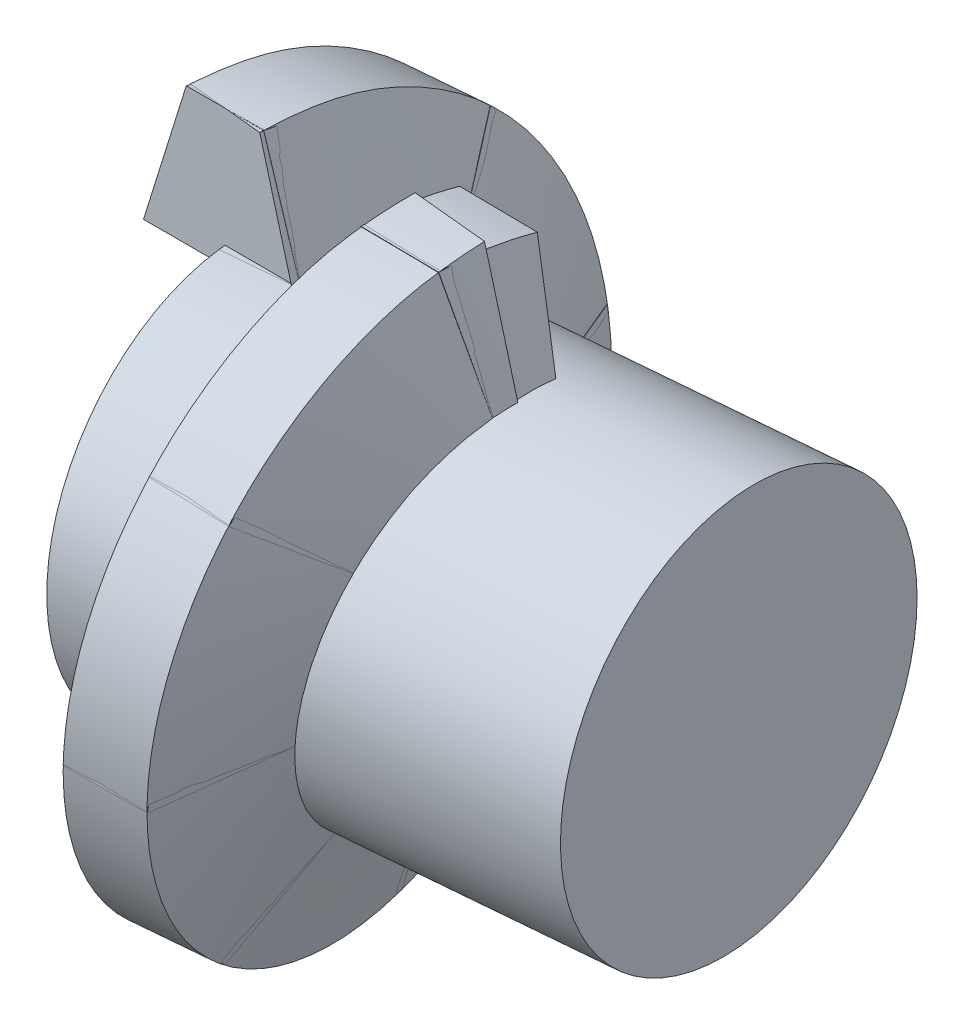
SolidWorks part; units mm, degrees
ref_plane "Ebene vorne" through (0, 0, 0) normal (0, 0, 1) x (1, 0, 0)
ref_plane "Ebene oben" through (0, 0, 0) normal (0, 1, 0) x (1, 0, 0)
ref_plane "Ebene rechts" through (0, 0, 0) normal (1, 0, 0) x (0, 0, -1)
sketch "Skizze1" plane through (0, 0, 0) normal (0, 0, 1) x (1, 0, 0)
  line L0 (-51.6626, 30) -> (0, 30) construction
  line L1 (0, 30) -> (0, 95.3164) construction
  line L2 (-13.7617, 30) -> (-6.5424, 53.129)
  line L3 (-6.5424, 53.129) -> (6.5424, 53.129)
  line L4 (0, 0) -> (87.3075, 0) construction
  line L5 (13.7617, 30) -> (-13.7617, 30)
  line L6 (13.7617, 30) -> (6.5424, 53.129)
  point P12 (0, 53.129)
  dimension "D1" = 30
sketch "Skizze2" plane through (0, 0, 0) normal (1, 0, 0) x (0, 0, -1)
  line L0 (0, 0) -> (-5, 0) construction
  line L1 (0, 0) -> (25.4682, 0) construction
  line L2 (0, 53.129) -> (9.3681, 0) construction
  line L3 (0, 0) -> (0, 53.129) construction
  line L4 (0, 0) -> (25.3439, 43.8969) construction
  arc A0 (25.3439, 43.8969) -> (0, 53.129) centre (-5, 0) ccw
  dimension "D1" = 5
  dimension "D2" = 10
  dimension "D3" = 30
sketch "Skizze7" plane through (0, 0, 0) normal (1, 0, 0) x (0, 0, -1)
  line L0 (0, 0) -> (0, 53.129) construction
  line L1 (9.9513, 26.0926) -> (-8, -5) construction
  line L3 (-2.7458, -5) -> (-34.3714, -5) construction
  line L4 (0, 0) -> (24.7497, 0) construction
  circle A0 centre (-8, -5) radius 35.9026
  dimension "D1" = 30
  dimension "D2" = 8
  dimension "D3" = 5
curve "Spirale/Helix2"
sketch3d "3D-Skizze2"
  spline S1 degree 3 poles (-0.39, -531.5654, -818.8173) (-6.8583, -118.0262, 158.7059) (-3.1091, 46.0704, 62.3696) (4.1091, 13.5606, -64.2476) (7.8583, -176.6474, -69.6138) (1.3901, -68.1116, 986.2091) knots -10.332342 -10.332342 -10.332342 -10.332342 0.333333 0.666667 11.332304 11.332304 11.332304 11.332304 only from (0, 30.9026, 8) to (1, 26.4617, -9.2962)
  spline S2 degree 3 poles (0.447, 30.0001, 0) (0.5203, 29.7057, -1.2878) (0.7045, 28.7857, -4.4889) (0.889, 27.4266, -7.5411) (1, 26.4617, -9.2962) knots 0.447042 0.447042 0.447042 0.447042 0.666667 1 1 1 1
  dimension "D1" = 0
sketch "Skizze3" plane through (0, 0, 0) normal (0, 1, 0) x (1, 0, 0)
  line L0 (0, 0) -> (0, -40.1752) construction
  line L1 (0, 0) -> (3.6001, -41.1493) construction
  dimension "D1" = 5
ref_plane "Ebene1" through (0, 0, 0) normal (0.9962, 0, -0.0872) x (-0.0872, 0, -0.9962)
sketch "Skizze5" plane through (0, 0, 0) normal (0.9962, 0, -0.0872) x (-0.0872, 0, -0.9962)
  circle A0 centre (0, 0) radius 30
curve "Spirale/Helix1"
sweep "Austragung1" add profiles "Skizze1" path "3D-Skizze2"
sketch3d "3D-Skizze1"
  spline S1 degree 3 poles (-132.1121, -907.8799, -1747.7142) (-8.1075, -184.0764, 202.0006) (-6.4031, 56.0022, 57.3211) (1.5831, 26.2792, -15.3679) (2.4883, 21.4569, -21.7568) (3.5207, 15.1723, -26.6876) (4.7093, 7.8538, -29.8347) (6.072, 0, -30.9918) (7.6149, -7.8538, -30.0889) (9.3319, -15.1723, -27.1961) (11.205, -21.4569, -22.5192) (13.2055, -26.2792, -16.3856) (15.2961, -29.3107, -9.222) (17.4334, -30.3447, -1.5252) (19.5707, -29.3107, 6.1716) (21.6613, -26.2792, 13.3352) (23.6619, -21.4569, 19.4687) (25.5349, -15.1723, 24.1456) (27.2519, -7.8538, 27.0384) (28.7948, 0, 27.9413) (30.1575, 7.8538, 26.7842) (31.3461, 15.1723, 23.6371) (32.3785, 21.4569, 18.7064) (33.2837, 26.2792, 12.3174) (41.2699, 56.0022, -60.3714) (42.9743, -184.0759, -205.0508) (166.9785, -907.8777, 1744.6578) knots -1.100611 -1.100611 -1.100611 -1.100611 0.041667 0.083333 0.125 0.166667 0.208333 0.25 0.291667 0.333333 0.375 0.416667 0.458333 0.5 0.541667 0.583333 0.625 0.666667 0.708333 0.75 0.791667 0.833333 0.875 0.916667 0.958333 2.100609 2.100609 2.100609 2.100609 only from (0, 30, 0) to (34.8668, 30, -3.0505)
  spline S2 degree 3 poles (0, 30, 0) (0.2554, 30, -2.6431) (0.7686, 29.3107, -7.9544) (1.5831, 26.2792, -15.3679) (2.4883, 21.4569, -21.7568) (3.5207, 15.1723, -26.6876) (4.7093, 7.8538, -29.8347) (6.072, 0, -30.9918) (7.6149, -7.8538, -30.0889) (9.3319, -15.1723, -27.1961) (11.205, -21.4569, -22.5192) (13.2055, -26.2792, -16.3856) (15.2961, -29.3107, -9.222) (17.4334, -30.3447, -1.5252) (19.5707, -29.3107, 6.1716) (21.6613, -26.2792, 13.3352) (23.6619, -21.4569, 19.4687) (25.5349, -15.1723, 24.1456) (27.2519, -7.8538, 27.0384) (28.7948, 0, 27.9413) (30.1575, 7.8538, 26.7842) (31.3461, 15.1723, 23.6371) (32.3785, 21.4569, 18.7064) (33.2837, 26.2792, 12.3174) (34.0982, 29.3107, 4.9039) (34.6114, 30, -0.4074) (34.8668, 30, -3.0505) knots 0 0 0 0 0.041667 0.083333 0.125 0.166667 0.208333 0.25 0.291667 0.333333 0.375 0.416667 0.458333 0.5 0.541667 0.583333 0.625 0.666667 0.708333 0.75 0.791667 0.833333 0.875 0.916667 0.958333 1 1 1 1
  dimension "D1" = 0
sketch "Skizze6" plane through (0, 0, 0) normal (0.9962, 0, -0.0872) x (-0.0872, 0, -0.9962)
  circle A0 centre (0, 0) radius 30
surface "Oberfläche-Linear austragen1" sketch "Skizze6" parameters "D1"=70
pattern_curve "Kurvenmuster1" parameters "D1"=9, "D3"=50, "D2"=1, "D4"=50
delete or keep bodies "Körper-Löschen1" type delete bodies bodies 104
sketch "Skizze4" plane through (0, 0, 0) normal (0.9962, 0, -0.0872) x (-0.0872, 0, -0.9962)
  circle A0 centre (0, 0) radius 33.094
extrude "Linear austragen2" add sketch "Skizze4" along normal blind 80
ref_plane "Ebene2" through (0, 30, 0) normal (0.0962, 0, -0.9954) x (-0.9954, 0, -0.0962)
sketch "Skizze8" plane through (0, 30, 0) normal (0.0962, 0, -0.9954) x (-0.9954, 0, -0.0962)
  line L0 (0, 0) -> (0, 34.9984) construction
  line L1 (0, 0) -> (0, 65.3164) construction
  line L2 (13.6979, 0) -> (6.5121, 23.129)
  line L3 (-13.6979, 0) -> (-6.5121, 23.129)
  line L4 (6.5121, 23.129) -> (-6.5121, 23.129)
surface "Oberfläche-Austragung1"
equation "\"LÄNGE\"=0"
equation "\"BREITE\"=0"
equation "\"HÖHE\"=0"
equation "\"DURCHMESSER\"=0"
equation "\"Stückzahl\"= 1"
